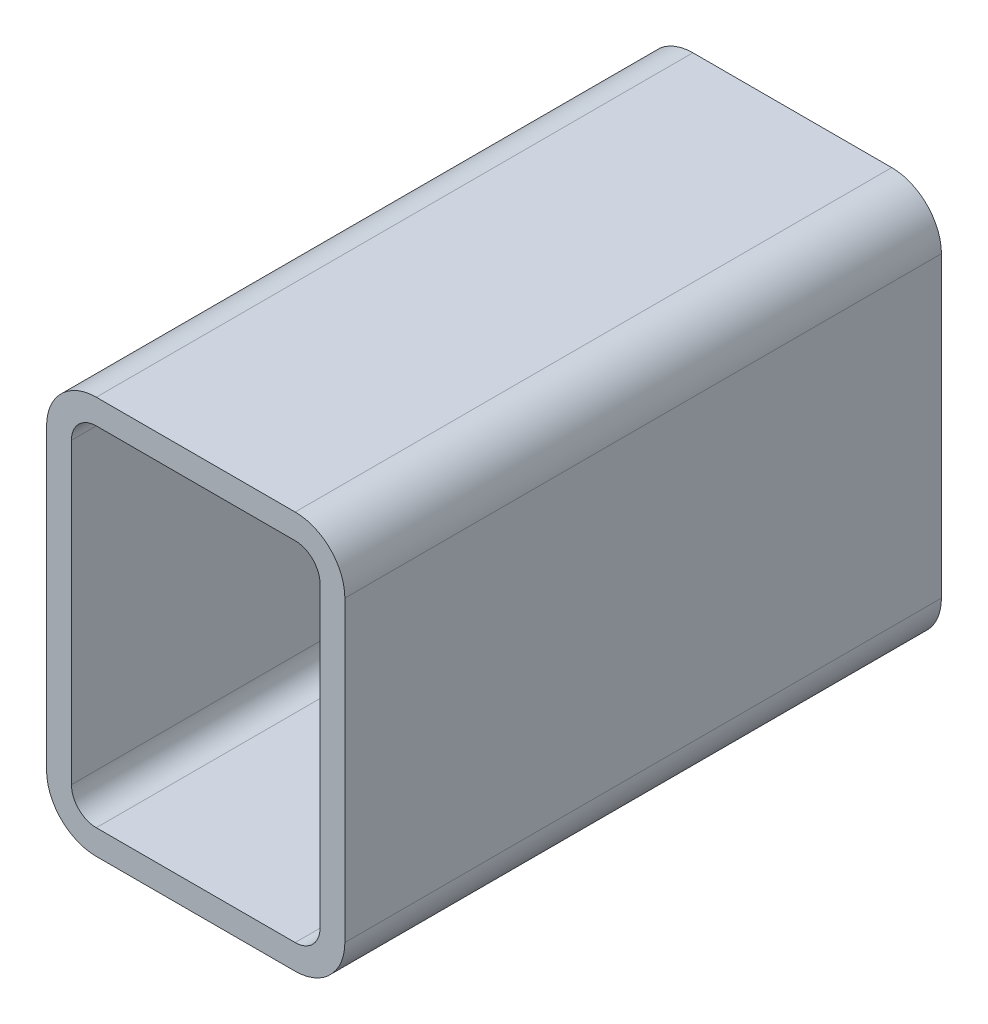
SolidWorks part; units mm, degrees
ref_plane "Front Plane" through (0, 0, 0) normal (0, 0, 1) x (1, 0, 0)
ref_plane "Top Plane" through (0, 0, 0) normal (0, 1, 0) x (1, 0, 0)
ref_plane "Right Plane" through (0, 0, 0) normal (1, 0, 0) x (0, 0, -1)
sketch "Sketch1" plane through (0, 0, 0) normal (0, 0, 1) x (1, 0, 0)
sketch_block_instance "HSS8x6x0.500-1"
sketch_block "HSS8x6x0.500"
extrude "Boss-Extrude1" add sketch "Sketch1" along normal blind 304.8
